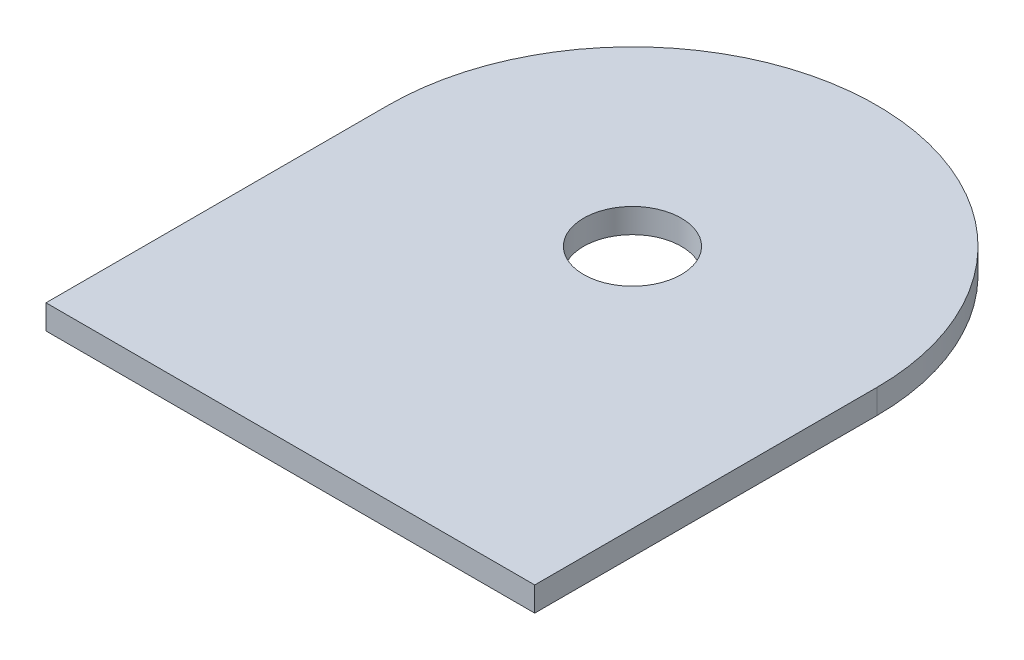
SolidWorks part; units mm, degrees
ref_plane "Front Plane" through (0, 0, 0) normal (0, 0, 1) x (1, 0, 0)
ref_plane "Top Plane" through (0, 0, 0) normal (0, 1, 0) x (1, 0, 0)
ref_plane "Right Plane" through (0, 0, 0) normal (1, 0, 0) x (0, 0, -1)
sketch "Sketch2" plane through (0, 0, 0) normal (0, 1, 0) x (1, 0, 0)
  line L0 (-43.75, 0) -> (43.75, 0) construction
  line L1 (20, 0) -> (20, -28)
  line L2 (20, -28) -> (-20, -28)
  line L4 (-20, 0) -> (-20, -28)
  circle A0 centre (0, 0) radius 4
  arc A1 (20, 0) -> (-20, 0) centre (0, 0) ccw
  point P7 (0, 0)
  dimension "D1" = 8
  dimension "D2" = 20
  dimension "D3" = 28
extrude "Boss-Extrude1" add sketch "Sketch2" along normal blind 2
